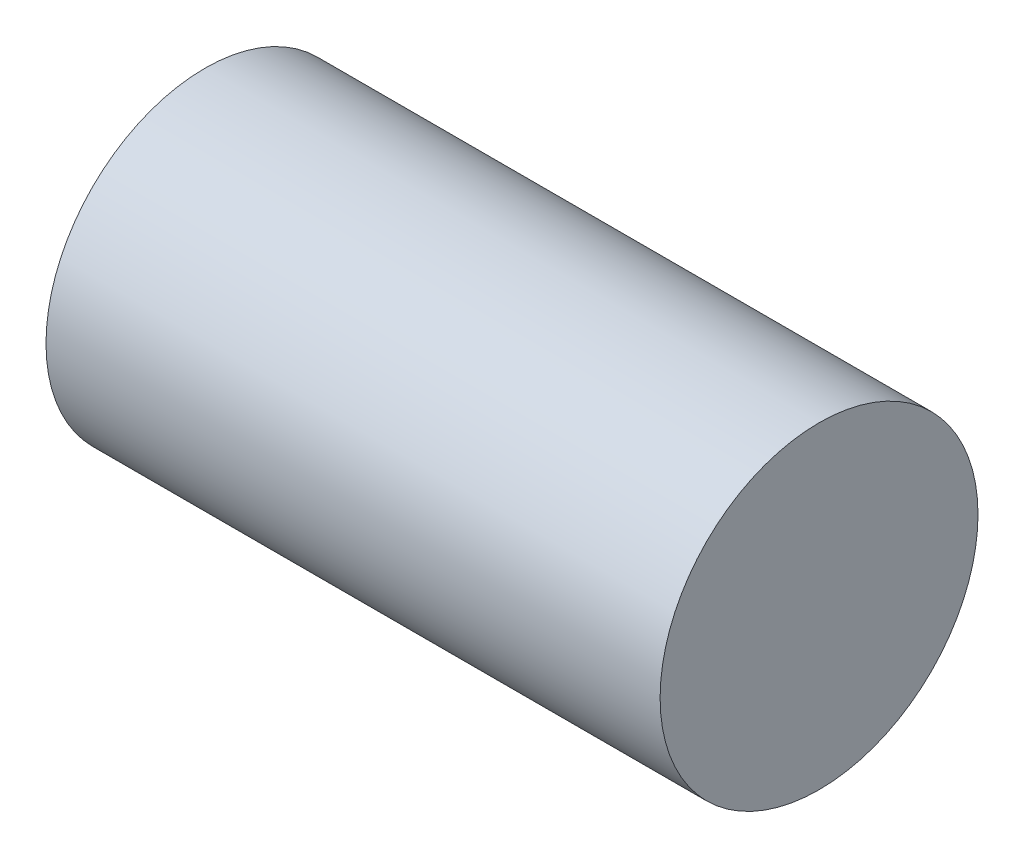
SolidWorks part; units mm, degrees
ref_plane "Face" through (0, 0, 0) normal (0, 0, 1) x (1, 0, 0)
ref_plane "Dessus" through (0, 0, 0) normal (0, 1, 0) x (1, 0, 0)
ref_plane "Droite" through (0, 0, 0) normal (1, 0, 0) x (0, 0, -1)
sketch "Esquisse1" plane through (0, 0, 0) normal (1, 0, 0) x (0, 0, -1)
  circle A0 centre (0, 0) radius 11
  dimension "D1" = 22
extrude "Extrusion1" add sketch "Esquisse1" along normal blind 42.5
